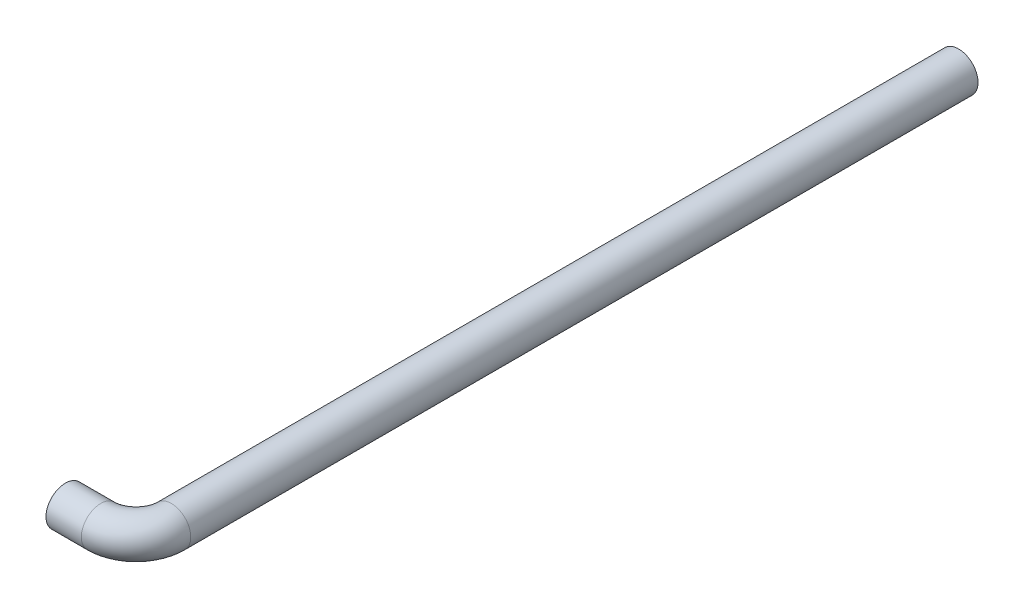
SolidWorks part; units mm, degrees
ref_plane "Front Plane" through (0, 0, 0) normal (0, 0, 1) x (1, 0, 0)
ref_plane "Top Plane" through (0, 0, 0) normal (0, 1, 0) x (1, 0, 0)
ref_plane "Right Plane" through (0, 0, 0) normal (1, 0, 0) x (0, 0, -1)
sketch "Sketch1" plane through (0, 0, 0) normal (1, 0, 0) x (0, 0, -1)
  circle A0 centre (0, 0) radius 1.65
  dimension "D1" = 3.3
sketch "Sketch2" plane through (0, 0, 0) normal (0, 1, 0) x (1, 0, 0)
  line L0 (0, 0) -> (3, 0)
  line L1 (6, 3) -> (6, 69.9)
  line L2 (0, -1.65) -> (0, 1.65) construction
  arc A0 (3, 0) -> (6, 3) centre (3, 3) ccw
  dimension "D3" = 69.9
  dimension "D2" = 3
  dimension "D1" = 6
ref_plane "Plane1" through (6.55, 0, 0) normal (1, 0, 0) x (0, 0, -1)
sweep "Sweep1" add profiles "Sketch1" path "Sketch2"
